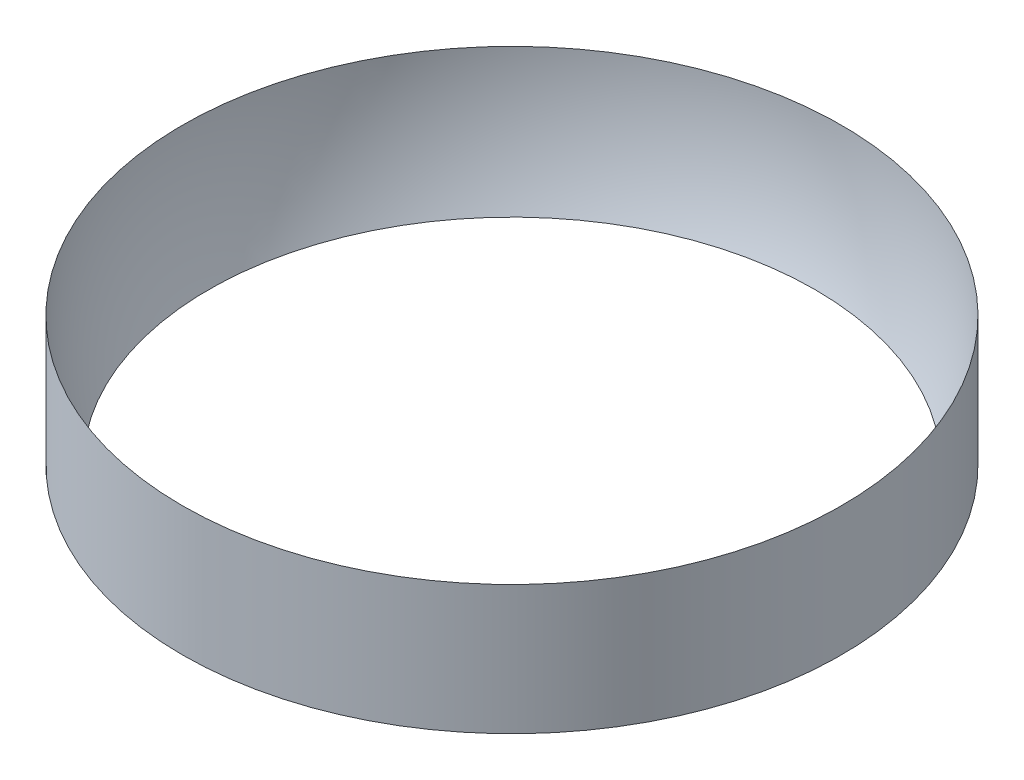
SolidWorks part; units mm, degrees
ref_plane "Front Plane" through (0, 0, 0) normal (0, 0, 1) x (1, 0, 0)
ref_plane "Top Plane" through (0, 0, 0) normal (0, 1, 0) x (1, 0, 0)
ref_plane "Right Plane" through (0, 0, 0) normal (1, 0, 0) x (0, 0, -1)
sketch "Sketch1" plane through (0, 0, 0) normal (0, 1, 0) x (1, 0, 0)
  circle A0 centre (0, 0) radius 6.477
  dimension "D1" = 12.954
extrude "Boss-Extrude1" add sketch "Sketch1" along normal blind 2.54
sketch "Sketch2" plane through (0, 2.54, 0) normal (0, 1, 0) x (1, 0, 0)
  line L0 (0, -6.477) -> (0, 6.477)
  arc A0 (0, -6.477) -> (0, 6.477) centre (0, 0) ccw
  circle A1 centre (0, 0) radius 6.477 construction
revolve "Cut-Revolve1" cut sketch "Sketch2" angle 360 about L0
